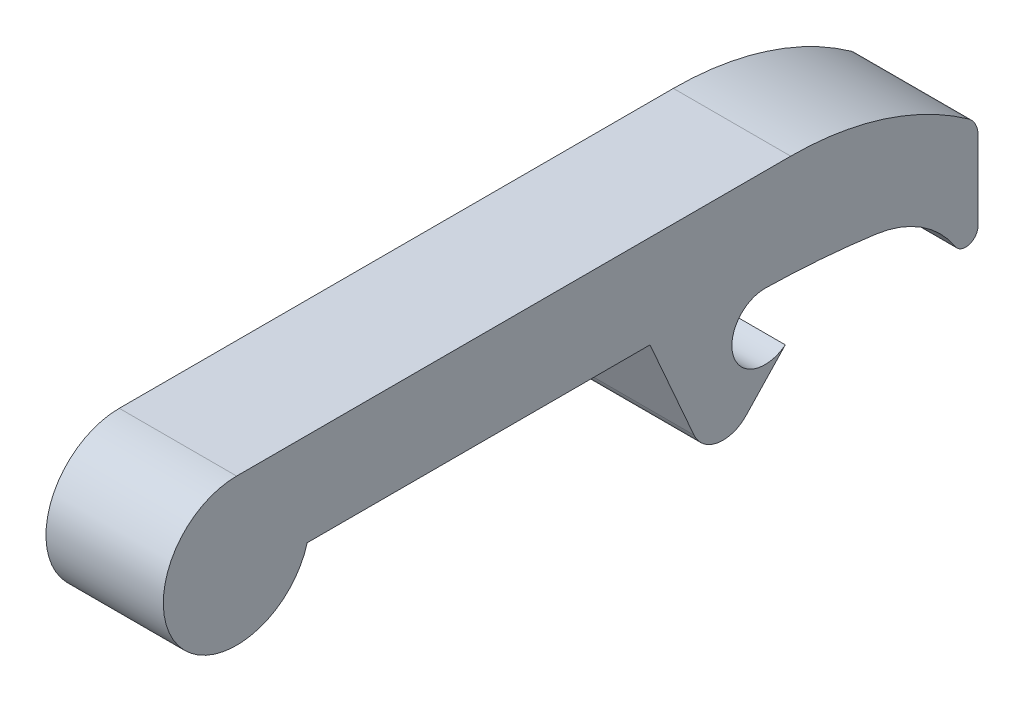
SolidWorks part; units mm, degrees
other "DetailItem1"
other "Title Block1"
ref_plane "Front" through (0, 0, 0) normal (0, 0, 1) x (1, 0, 0)
ref_plane "Top" through (0, 0, 0) normal (0, 1, 0) x (1, 0, 0)
ref_plane "Right" through (0, 0, 0) normal (1, 0, 0) x (0, 0, -1)
sketch "Sketch1" plane through (0, 0, 0) normal (1, 0, 0) x (0, 0, -1)
  line L0 (-286.1952, 21.3787) -> (13.6201, 21.3787)
  line L1 (114.9561, -19.2579) -> (114.9561, -61.9717)
  line L2 (10.6894, -65.5802) -> (-10.5223, -88.079)
  line L3 (-38.6844, -83.2179) -> (-62.5236, -28.9798)
  line L4 (-62.5236, -28.9798) -> (-247.9934, -28.9798)
  arc A0 (13.6201, 21.3787) -> (109.8011, -9.279) centre (13.6201, -144.8223) cw
  arc A1 (109.8011, -9.279) -> (114.9561, -19.2579) centre (102.7201, -19.2579) cw
  arc A2 (114.9561, -61.9717) -> (102.7201, -65.5802) centre (108.306, -61.9717) cw
  arc A3 (102.7201, -65.5802) -> (59.7978, -38.2588) centre (51.5031, -98.6663) ccw
  arc A4 (59.7978, -38.2588) -> (0, -33.6193) centre (-9.3551, -541.8797) ccw
  arc A5 (0, -33.6193) -> (10.6894, -65.5802) centre (-0.3291, -51.4973) ccw
  arc A6 (-10.5223, -88.079) -> (-38.6844, -83.2179) centre (-22.9934, -76.3213) cw
  arc A7 (-286.1952, 21.3787) -> (-247.9934, -28.9798) centre (-286.1952, -18.2905) ccw
extrude "Extrude1" add sketch "Sketch1" along normal mid plane 63.5
sketch "Sketch3" plane through (31.75, 0, 0) normal (1, 0, 0) x (0, 0, -1)
  circle A0 centre (-286.1952, -18.2905) radius 17.5362
extrude "Cut-Extrude1" [suppressed] cut sketch "Sketch3" against normal through all
